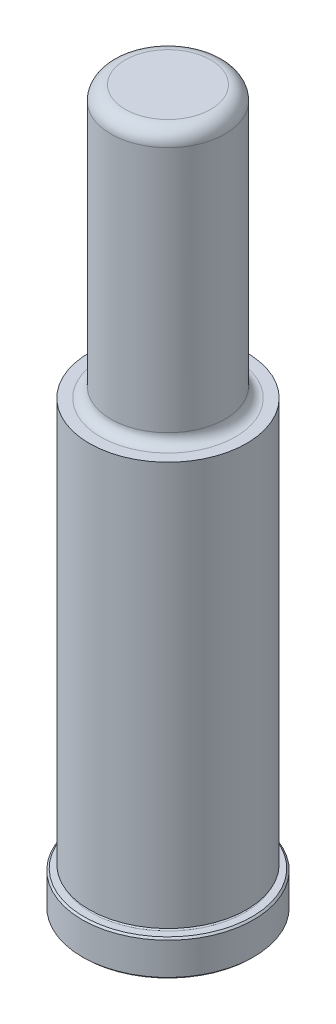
SolidWorks part; units mm, degrees
ref_plane "Front Plane" through (0, 0, 0) normal (0, 0, 1) x (1, 0, 0)
ref_plane "Top Plane" through (0, 0, 0) normal (0, 1, 0) x (1, 0, 0)
ref_plane "Right Plane" through (0, 0, 0) normal (1, 0, 0) x (0, 0, -1)
sketch "Sketch1" plane through (0, 0, 0) normal (1, 0, 0) x (0, 0, -1)
  line L0 (0, 0) -> (19.05, 0)
  line L1 (19.05, 0) -> (19.05, 7.9248)
  line L2 (19.05, 7.9248) -> (17.0688, 7.9248)
  line L3 (16.6878, 2.6782) -> (16.6878, 5.9795) construction
  line L4 (17.0688, 8.6868) -> (17.4752, 8.6868)
  line L5 (17.4752, 8.6868) -> (17.4752, 98.425)
  line L6 (17.4752, 98.425) -> (14.9733, 98.425)
  line L7 (12.6873, 100.711) -> (12.6873, 158.75)
  line L9 (12.6873, 158.75) -> (0, 158.75)
  line L10 (0, 158.75) -> (0, 0)
  line L11 (0, 0) -> (0, -7.2694) construction
  arc A0 (17.0688, 8.6868) -> (17.0688, 7.9248) centre (17.0688, 8.3058) ccw
  arc A1 (14.9733, 98.425) -> (12.6873, 100.711) centre (14.9733, 100.711) cw
  point P2 (12.6873, 158.75)
  point P14 (12.6873, 159.0072)
  point P19 (12.6873, 98.425)
  dimension "D14" = 0.762
  dimension "D8" = 2.286
  dimension "T" = 7.9248
  dimension "D2" = 0.762
  dimension "M" = 38.1
  dimension "B" = 34.9504
  dimension "L" = 158.75
  dimension "D7" = 0.7874
  dimension "A" = 98.425
  dimension "D" = 25.3746
  dimension "D15" = 60.325
revolve "Revolve1" add sketch "Sketch1" angle 360 about L11
chamfer "Chamfer1" distance 0.381 angle 45 2 edges at (0, 0, 19.05) (0, 7.9248, 19.05)
fillet "Fillet7" radius 3.175 1 edges at (0, 158.75, 12.6873)
